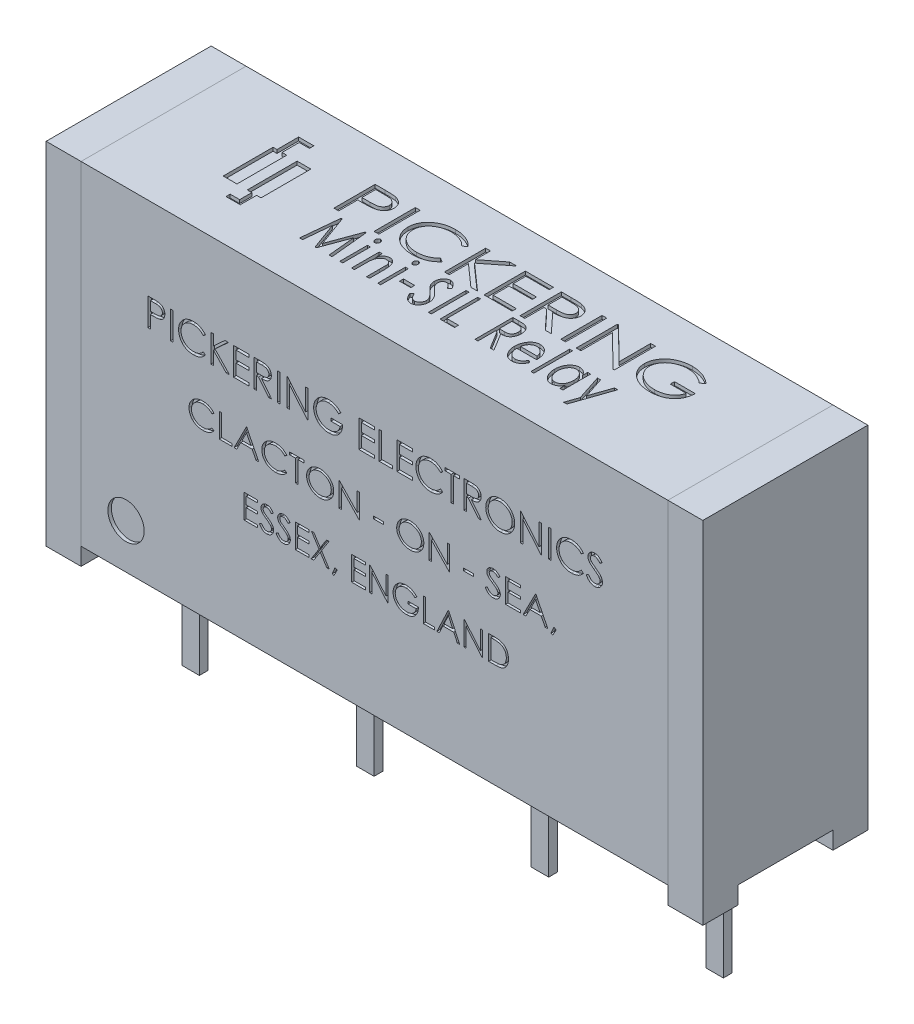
SolidWorks part; units mm, degrees
ref_plane "Front Plane" through (0, 0, 0) normal (0, 0, 1) x (1, 0, 0)
ref_plane "Top Plane" through (0, 0, 0) normal (0, 1, 0) x (1, 0, 0)
ref_plane "Right Plane" through (0, 0, 0) normal (1, 0, 0) x (0, 0, -1)
sketch "Sketch1" plane through (0, 0, 0) normal (0, 1, 0) x (1, 0, 0)
  line L1 (8.534, -2.4) -> (-8.534, -2.4)
  line L2 (8.534, -2.4) -> (8.534, 2.4)
  line L3 (8.534, 2.4) -> (-8.534, 2.4)
  line L4 (-8.534, -2.4) -> (-8.534, 2.4)
  line L5 (8.534, -2.4) -> (-8.534, 2.4) construction
  line L6 (8.534, 2.4) -> (-8.534, -2.4) construction
  point P0 (0, 0)
  dimension "D1" = 4.8
  dimension "D2" = 17.068
extrude "main box" add sketch "Sketch1" along normal blind 9.692
sketch "Sketch2" plane through (-8.534, 0, 0) normal (-1, 0, 0) x (0, 0, 1)
  line L0 (-2.4, 9.692) -> (2.4, 9.692)
  line L1 (2.4, 9.692) -> (2.4, -0.508)
  line L2 (2.4, -0.508) -> (-2.4, -0.508)
  line L3 (-2.4, -0.508) -> (-2.4, 9.692)
  dimension "D1" = 10.2
extrude "end section plus feet" add sketch "Sketch2" along normal blind 1.016 separate body
sketch "Sketch4" plane through (0, 0, 0) normal (0, -1, 0) x (1, 0, 0)
  line L1 (-7.874, -0.127) -> (-7.366, -0.127)
  line L2 (-7.874, -0.127) -> (-7.874, 0.127)
  line L3 (-7.874, 0.127) -> (-7.366, 0.127)
  line L4 (-7.366, -0.127) -> (-7.366, 0.127)
  line L5 (-7.874, -0.127) -> (-7.366, 0.127) construction
  line L6 (-7.874, 0.127) -> (-7.366, -0.127) construction
  line L13 (-2.286, -0.127) -> (-2.794, -0.127)
  line L14 (-2.286, -0.127) -> (-2.286, 0.127)
  line L15 (-2.286, 0.127) -> (-2.794, 0.127)
  line L16 (-2.794, -0.127) -> (-2.794, 0.127)
  line L17 (-2.286, -0.127) -> (-2.794, 0.127) construction
  line L18 (-2.286, 0.127) -> (-2.794, -0.127) construction
  line L19 (-9.55, 2.4) -> (-9.55, -2.4) construction
  line L20 (2.794, -0.127) -> (2.286, -0.127)
  line L21 (2.794, -0.127) -> (2.794, 0.127)
  line L22 (2.794, 0.127) -> (2.286, 0.127)
  line L23 (2.286, -0.127) -> (2.286, 0.127)
  line L24 (2.794, -0.127) -> (2.286, 0.127) construction
  line L25 (2.794, 0.127) -> (2.286, -0.127) construction
  line L26 (7.874, -0.127) -> (7.366, -0.127)
  line L27 (7.874, -0.127) -> (7.874, 0.127)
  line L28 (7.874, 0.127) -> (7.366, 0.127)
  line L29 (7.366, -0.127) -> (7.366, 0.127)
  line L30 (7.874, -0.127) -> (7.366, 0.127) construction
  line L31 (7.874, 0.127) -> (7.366, -0.127) construction
  point P0 (-7.62, 0)
  point P11 (-2.54, 0)
  point P18 (2.54, 0)
  point P23 (7.62, 0)
  dimension "D1" = 0.254
  dimension "D2" = 0.508
  dimension "D3" = 5.08
  dimension "D5" = 0.254
  dimension "D6" = 0.508
  dimension "D7" = 1.93
  dimension "D10" = 5.08
  dimension "D11" = 0.254
  dimension "D12" = 0.508
  dimension "D13" = 0.254
  dimension "D14" = 0.508
  dimension "D15" = 5.08
extrude "Pins" add sketch "Sketch4" along normal blind 3.808
sketch "Sketch6"
  dimension "D1" = 10.15
  dimension "D2" = 9.25
  dimension "D3" = 5.7
  dimension "D4" = 6.05
  dimension "D5" = 2.3
  dimension "D6" = 1.25
extrude "Top writing" cut sketch "Sketch6" against normal blind 0.1
sketch "Sketch7"
  dimension "D1" = 14
  dimension "D2" = 2.55
extrude "Pickering electronics" cut sketch "Sketch7" against normal blind 0.1
sketch "Sketch8"
  dimension "D1" = 11
  dimension "D2" = 4
extrude "Address" cut sketch "Sketch8" against normal blind 0.1
sketch "Sketch9" plane through (0, 9.692, 0) normal (0, 1, 0) x (1, 0, 0)
  line L0 (8.534, 2.4) -> (-8.534, 2.4) construction
  line L1 (-5.4, 0.75) -> (-5, 0.75)
  line L2 (-5.4, 0.75) -> (-5.4, -0.7)
  line L3 (-5.4, -0.7) -> (-5.2668, -0.7)
  line L4 (-5, 0.75) -> (-5, -0.7)
  line L5 (-9.55, -2.4) -> (-9.55, 2.4) construction
  line L6 (-5.7, 0.75) -> (-5.8385, 0.75)
  line L7 (-5.7, 0.75) -> (-5.7, -0.7)
  line L8 (-5.7, -0.7) -> (-6.1, -0.7)
  line L9 (-6.1, 0.75) -> (-6.1, -0.7)
  line L10 (-5.9858, 0.75) -> (-6.1, 0.75)
  line L11 (-5.1282, -0.7) -> (-5, -0.7)
  line L12 (-5.9858, 0.75) -> (-5.9858, 1.3793)
  line L13 (-5.9858, 1.3793) -> (-5.8385, 1.3793)
  line L14 (-5.8385, 0.75) -> (-5.8385, 1.2494)
  line L15 (-5.8385, 1.3793) -> (-5.544, 1.3793)
  line L17 (-5.8385, 1.2494) -> (-5.544, 1.2494)
  line L18 (-5.544, 1.3793) -> (-5.544, 1.2494)
  line L20 (-5.1282, -0.7) -> (-5.1282, -1.176)
  line L21 (-5.1282, -1.176) -> (-5.2668, -1.176)
  line L22 (-5.2668, -0.7) -> (-5.2668, -1.0548)
  line L23 (-5.2668, -1.176) -> (-5.544, -1.176)
  line L25 (-5.2668, -1.0548) -> (-5.544, -1.0548)
  line L26 (-5.544, -1.176) -> (-5.544, -1.0548)
  dimension "D1" = 1.65
  dimension "D2" = 1.45
  dimension "D3" = 0.4
  dimension "D4" = 0.4
  dimension "D5" = 0.3
  dimension "D6" = 3.45
extrude "Pickering logo" cut sketch "Sketch9" against normal blind 0.1
sketch "Sketch10"
  dimension "D1" = 3.4
  dimension "D2" = 4
  dimension "D3" = 11.5
extrude "Extrude7" add sketch "Sketch10" along normal blind 0.0001
sketch "Sketch11" plane through (8.534, 0, 0) normal (1, 0, 0) x (0, 0, -1)
  line L1 (-2.4, 9.692) -> (2.4, 9.692)
  line L2 (-2.4, 9.692) -> (-2.4, -0.508)
  line L3 (-2.4, -0.508) -> (2.4, -0.508)
  line L4 (2.4, 9.692) -> (2.4, -0.508)
extrude "Extrude8" add sketch "Sketch11" along normal blind 1.016 separate body
sketch "Sketch12" plane through (-9.55, 0, 0) normal (-1, 0, 0) x (0, 0, 1)
  line L0 (-2.4, -0.508) -> (2.4, -0.508) construction
  line L1 (-1.384, -0.508) -> (1.384, -0.508)
  line L2 (-1.384, -0.508) -> (-1.384, 0)
  line L3 (-1.384, 0) -> (1.384, 0)
  line L4 (1.384, -0.508) -> (1.384, 0)
  line L5 (2.4, -0.508) -> (2.4, 9.692) construction
  dimension "D1" = 0.508
  dimension "D2" = 2.768
  dimension "D3" = 1.016
extrude "Extrude9" cut sketch "Sketch12" against normal blind 1.016
sketch "Sketch13" plane through (9.55, 0, 0) normal (1, 0, 0) x (0, 0, -1)
  line L0 (-2.4, -0.508) -> (2.4, -0.508) construction
  line L1 (-1.384, -0.508) -> (1.384, -0.508)
  line L2 (-1.384, -0.508) -> (-1.384, 0)
  line L3 (-1.384, 0) -> (1.384, 0)
  line L4 (1.384, -0.508) -> (1.384, 0)
  line L6 (2.4, -0.508) -> (2.4, 9.692) construction
  dimension "D1" = 0.508
  dimension "D2" = 2.768
  dimension "D3" = 1.016
extrude "Extrude10" cut sketch "Sketch13" against normal blind 1.016
